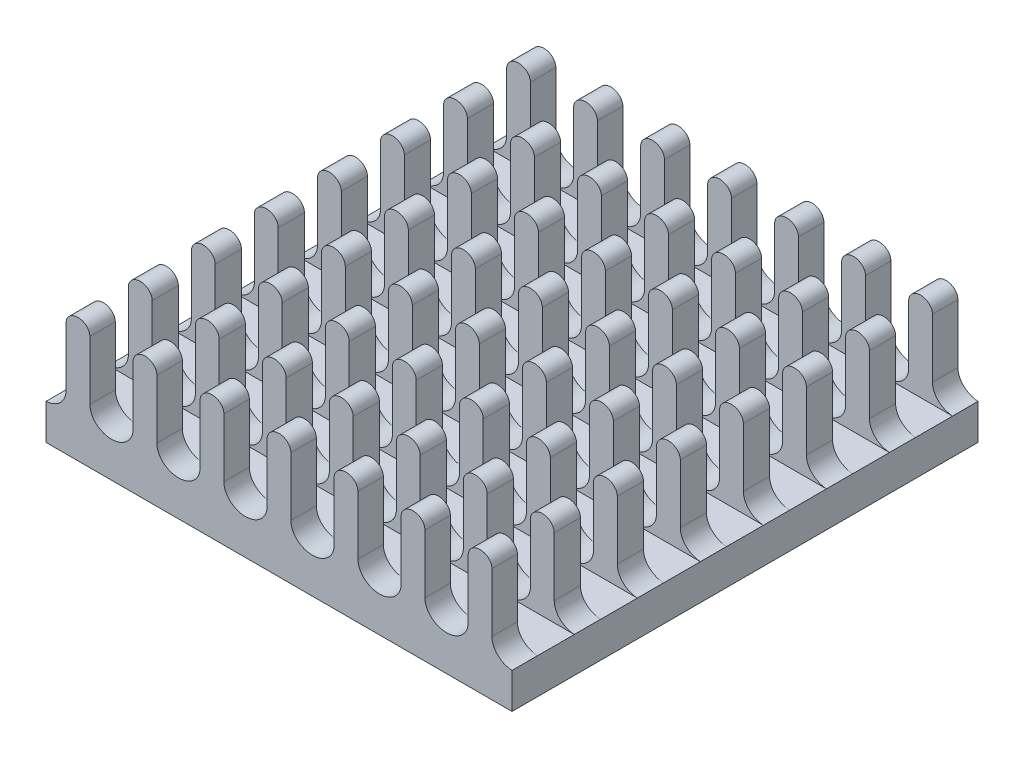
SolidWorks part; units mm, degrees
ref_plane "Front Plane" through (0, 0, 0) normal (0, 0, 1) x (1, 0, 0)
ref_plane "Top Plane" through (0, 0, 0) normal (0, 1, 0) x (1, 0, 0)
ref_plane "Right Plane" through (0, 0, 0) normal (1, 0, 0) x (0, 0, -1)
inserted part "heatsink_wakefield-628-35AB"
inserted part "Misumi-HEAT1-50"
inserted part "SW3dPS-vicor 28074 hs"
